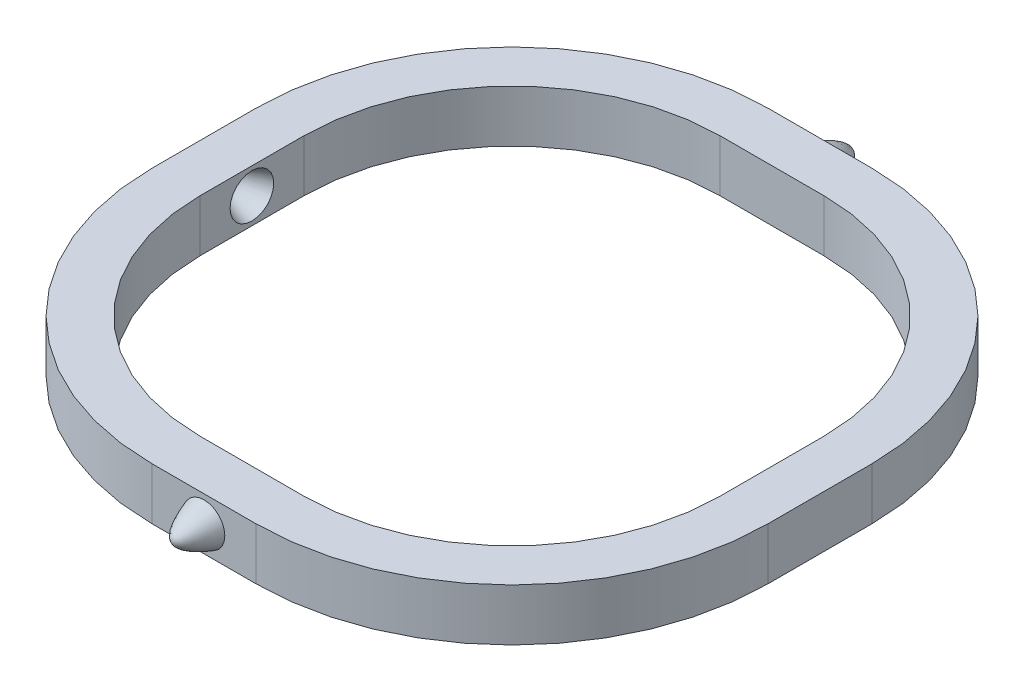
SolidWorks part; units mm, degrees
ref_plane "Front Plane" through (0, 0, 0) normal (0, 0, 1) x (1, 0, 0)
ref_plane "Top Plane" through (0, 0, 0) normal (0, 1, 0) x (1, 0, 0)
ref_plane "Right Plane" through (0, 0, 0) normal (1, 0, 0) x (0, 0, -1)
sketch "Sketch3" plane through (0, 0, 0) normal (0, 1, 0) x (1, 0, 0)
  line L0 (-54.6, 30) -> (-54.6, -30)
  line L1 (-30, 50) -> (30, 50)
  line L2 (-50, 30) -> (-50, -30)
  line L3 (-30, -50) -> (30, -50)
  line L4 (50, 30) -> (50, -30)
  line L5 (-50, 50) -> (50, -50) construction
  line L6 (-50, -50) -> (50, 50) construction
  line L7 (-30, -54.6) -> (30, -54.6)
  line L8 (54.6, 30) -> (54.6, -30)
  line L9 (-30, 54.6) -> (30, 54.6)
  arc A0 (30, -50) -> (50, -30) centre (30, -30) ccw
  arc A1 (30, 50) -> (50, 30) centre (30, 30) cw
  arc A2 (-30, 50) -> (-50, 30) centre (-30, 30) ccw
  arc A3 (-50, -30) -> (-30, -50) centre (-30, -30) ccw
  arc A4 (-54.6, -30) -> (-30, -54.6) centre (-30, -30) ccw
  arc A5 (30, -54.6) -> (54.6, -30) centre (30, -30) ccw
  arc A6 (30, 54.6) -> (54.6, 30) centre (30, 30) cw
  arc A7 (-30, 54.6) -> (-54.6, 30) centre (-30, 30) ccw
  point P0 (0, 0)
  dimension "D2" = 20
  dimension "D1" = 100
  dimension "D3" = 4.6
extrude "Boss-Extrude2" add sketch "Sketch3" along normal blind 5
sketch "Sketch4" plane through (0, 0, 0) normal (1, 0, 0) x (0, 0, -1)
  line L0 (-54.6, 5) -> (-54.6, 0) construction
  line L1 (-54.6, 4.5) -> (-60.6, 2.5) construction
  line L2 (-60.6, 2.5) -> (-54.6, 0.5) construction
  line L3 (-57.6, 2.5) -> (-54.6, 2.5)
  line L4 (-54.6, 2.5) -> (-54.6, 0.5)
  line L5 (-30, 5) -> (-54.6, 5) construction
  line L6 (-57.6, 2.5) -> (-60.6, 2.5) construction
  spline S0 degree 2 poles (-54.6, 4.5) (-60.6, 2.5) (-54.6, 0.5) knots 0 0 0 1 1 1
  dimension "D1" = 0.5
  dimension "D2" = 0.5
  dimension "D3" = 3
revolve "Revolve4" add sketch "Sketch4" angle 360 about L6
mirror "Mirror1" about plane through (0, 0, 0) normal (0, 0, 1) of "Revolve4"
sketch "Sketch6" plane through (0, 5, 0) normal (0, 1, 0) x (1, 0, 0)
  line L0 (0, 0) -> (0, 57.6) construction
  line L1 (0, 0) -> (0, -57.6) construction
  circle A0 centre (0, 0) radius 28.8 construction
  point P3 (0, -28.8)
sketch "Sketch8" plane through (0, 0, 0) normal (0, 0, 1) x (1, 0, 0)
  line L0 (-50, 5) -> (-50, 0) construction
  line L1 (-50, 4.6) -> (-56.4, 2.5) construction
  line L2 (-56.4, 2.5) -> (-50, 0.4) construction
  line L3 (-53.2, 2.5) -> (-50, 2.5)
  line L4 (-53.2, 2.5) -> (-56.4, 2.5) construction
  line L5 (-50, 0.4) -> (-50, 2.5)
  spline S0 degree 2 poles (-50, 4.6) (-56.4, 2.5) (-50, 0.4) knots 0 0 0 1 1 1
  dimension "D1" = 0.4
  dimension "D2" = 0.4
  dimension "D3" = 3.2
revolve "Cut-Revolve1" cut sketch "Sketch8" angle 360 about L4
mirror "Mirror2" about plane through (0, 0, 0) normal (1, 0, 0) of "Cut-Revolve1"
sketch "Sketch9" plane through (0, 0, 0) normal (0, -1, 0) x (1, 0, 0)
  line L0 (-30, 54.6) -> (30, 54.6) construction
  line L1 (-11.1139, 54.6) -> (9.1689, 54.6)
  line L2 (-11.1139, 54.6) -> (-11.1139, 64.8772)
  line L3 (-11.1139, 64.8772) -> (9.1689, 64.8772)
  line L4 (9.1689, 54.6) -> (9.1689, 64.8772)
  line L5 (30, -54.6) -> (-30, -54.6) construction
  line L6 (-9.4468, -54.6) -> (7.6408, -54.6)
  line L7 (-9.4468, -54.6) -> (-9.4468, -65.4329)
  line L8 (-9.4468, -65.4329) -> (7.6408, -65.4329)
  line L9 (7.6408, -54.6) -> (7.6408, -65.4329)
extrude "Cut-Extrude1" cut sketch "Sketch9" against normal blind 10
fillet "Fillet1" radius 1 32 edges at (0, 0, 50) (-44.1421, 0, 44.1421) (-50, 0, 0) (-44.1421, 0, -44.1421) (0, 0, -50) (44.1421, 0, -44.1421) (50, 0, 0) (44.1421, 0, 44.1421) (-54.6, 0, 0) (-47.3948, 0, 47.3948) (0, 0, 54.6) (47.3948, 0, 47.3948) (54.6, 0, 0) (47.3948, 0, -47.3948) (0, 0, -54.6) (-47.3948, 0, -47.3948) (44.1421, 5, -44.1421) (0, 5, -50) (-44.1421, 5, -44.1421) (-50, 5, 0) (-44.1421, 5, 44.1421) (0, 5, 50) (44.1421, 5, 44.1421) (50, 5, 0) (0, 5, -54.6) (47.3948, 5, -47.3948) (54.6, 5, 0) (47.3948, 5, 47.3948) (0, 5, 54.6) (-47.3948, 5, 47.3948) (-54.6, 5, 0) (-47.3948, 5, -47.3948)
